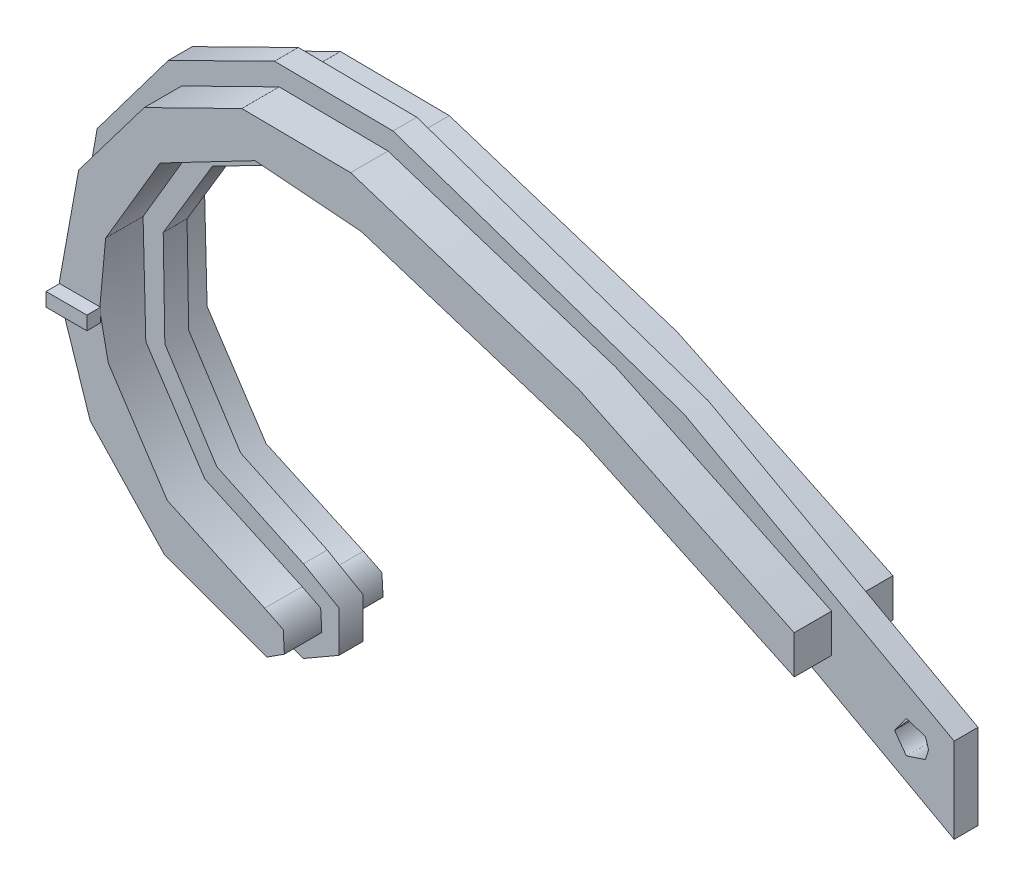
SolidWorks part; units mm, degrees
ref_plane "Plan de face" through (0, 0, 0) normal (0, 0, 1) x (1, 0, 0)
ref_plane "Plan de dessus" through (0, 0, 0) normal (0, 1, 0) x (1, 0, 0)
ref_plane "Plan de droite" through (0, 0, 0) normal (1, 0, 0) x (0, 0, -1)
sketch "Esquisse1" plane through (0, 0, 0) normal (0, 0, 1) x (1, 0, 0)
  line L0 (0, 0) -> (-129, 0) construction
  line L1 (0, 0) -> (0, -12.5)
  line L2 (-82.4299, 36.3971) -> (-82.4299, 23.8971) construction
  line L3 (-91.3509, 0) -> (-129, 0) construction
  arc A0 (0, 0) -> (-82.4299, 36.3971) centre (-146.1025, -219.3442) ccw
  arc A1 (0, -12.5) -> (-82.4299, 23.8971) centre (-146.1025, -231.8442) ccw
  arc A2 (-82.4299, 23.8971) -> (-95.5825, -25.2281) centre (-91.4918, 0) ccw
  arc A3 (-82.4299, 36.3971) -> (-95.5825, -37.2845) centre (-91.4918, 0) ccw
  arc A4 (-95.5825, -25.2281) -> (-95.5825, -37.2845) centre (-95.5825, -31.2563) cw
  dimension "D3" = 12.5
  dimension "D1" = 12.5
  dimension "D2" = 129
extrude "Boss.-Extru.1" add sketch "Esquisse1" along normal blind 14.5
sketch "Esquisse2" plane through (0, 0, 14.5) normal (0, 0, 1) x (1, 0, 0)
  line L2 (0, -12.5) -> (0, 0)
  line L3 (0, -12.5) -> (0, 0)
  line L5 (-3, -6.9669) -> (-3, -1.6123)
  line L6 (-3, -6.9669) -> (-3, -1.6123)
  arc A5 (0, 0) -> (-82.4299, 36.3971) centre (-146.1025, -219.3442) ccw
  arc A6 (0, 0) -> (-82.4299, 36.3971) centre (-146.1025, -219.3442) ccw
  arc A7 (-82.4299, 36.3971) -> (-95.5825, -37.2845) centre (-91.4918, 0) ccw
  arc A8 (-82.4299, 36.3971) -> (-95.5825, -37.2845) centre (-91.4918, 0) ccw
  arc A9 (-95.5825, -37.2845) -> (-95.5825, -25.2281) centre (-95.5825, -31.2563) ccw
  arc A10 (-95.5825, -37.2845) -> (-95.5825, -25.2281) centre (-95.5825, -31.2563) ccw
  arc A11 (-82.4299, 23.8971) -> (-95.5825, -25.2281) centre (-91.4918, 0) ccw
  arc A12 (-82.4299, 23.8971) -> (-95.5825, -25.2281) centre (-91.4918, 0) ccw
  arc A13 (0, -12.5) -> (-82.4299, 23.8971) centre (-146.1025, -231.8442) ccw
  arc A14 (0, -12.5) -> (-82.4299, 23.8971) centre (-146.1025, -231.8442) ccw
  arc A15 (-3, -1.6123) -> (-83.1547, 33.486) centre (-146.1025, -219.3442) ccw
  arc A16 (-3, -1.6123) -> (-83.1547, 33.486) centre (-146.1025, -219.3442) ccw
  arc A17 (-83.1547, 33.486) -> (-95.443, -34.2813) centre (-91.4918, 0) ccw
  arc A18 (-83.1547, 33.486) -> (-95.443, -34.2813) centre (-91.4918, 0) ccw
  arc A19 (-95.443, -34.2813) -> (-95.7766, -28.2343) centre (-95.5825, -31.2563) ccw
  arc A20 (-95.443, -34.2813) -> (-95.7766, -28.2343) centre (-95.5825, -31.2563) ccw
  arc A21 (-81.5368, 26.7663) -> (-95.7766, -28.2343) centre (-91.4918, 0) ccw
  arc A22 (-81.5368, 26.7663) -> (-95.7766, -28.2343) centre (-91.4918, 0) ccw
  arc A23 (-3, -6.9669) -> (-81.5368, 26.7663) centre (-146.1025, -231.8442) ccw
  arc A24 (-3, -6.9669) -> (-81.5368, 26.7663) centre (-146.1025, -231.8442) ccw
  dimension "D1" = 0
  dimension "D2" = 3
extrude "Enlèv. mat.-Extru.1" cut sketch "Esquisse2" against normal blind 5.5
sketch "Esquisse3" plane through (0, 0, 0) normal (0, 0, -1) x (-1, 0, 0)
  line L1 (3, -1.6123) -> (3, -6.9669)
  line L2 (3, -1.6123) -> (3, -6.9669)
  line L3 (0, 0) -> (0, -12.5)
  line L4 (0, 0) -> (0, -12.5)
  arc A5 (83.1547, 33.486) -> (3, -1.6123) centre (146.1025, -219.3442) ccw
  arc A6 (83.1547, 33.486) -> (3, -1.6123) centre (146.1025, -219.3442) ccw
  arc A7 (95.443, -34.2813) -> (83.1547, 33.486) centre (91.4918, 0) ccw
  arc A8 (95.443, -34.2813) -> (83.1547, 33.486) centre (91.4918, 0) ccw
  arc A9 (95.7766, -28.2343) -> (95.443, -34.2813) centre (95.5825, -31.2563) ccw
  arc A10 (95.7766, -28.2343) -> (95.443, -34.2813) centre (95.5825, -31.2563) ccw
  arc A11 (95.7766, -28.2343) -> (81.5368, 26.7663) centre (91.4918, 0) ccw
  arc A12 (95.7766, -28.2343) -> (81.5368, 26.7663) centre (91.4918, 0) ccw
  arc A13 (81.5368, 26.7663) -> (3, -6.9669) centre (146.1025, -231.8442) ccw
  arc A14 (81.5368, 26.7663) -> (3, -6.9669) centre (146.1025, -231.8442) ccw
  arc A15 (82.4299, 36.3971) -> (0, 0) centre (146.1025, -219.3442) ccw
  arc A16 (82.4299, 36.3971) -> (0, 0) centre (146.1025, -219.3442) ccw
  arc A17 (95.5825, -37.2845) -> (82.4299, 36.3971) centre (91.4918, 0) ccw
  arc A18 (95.5825, -37.2845) -> (82.4299, 36.3971) centre (91.4918, 0) ccw
  arc A19 (95.5825, -25.2281) -> (95.5825, -37.2845) centre (95.5825, -31.2563) ccw
  arc A20 (95.5825, -25.2281) -> (95.5825, -37.2845) centre (95.5825, -31.2563) ccw
  arc A21 (95.5825, -25.2281) -> (82.4299, 23.8971) centre (91.4918, 0) ccw
  arc A22 (95.5825, -25.2281) -> (82.4299, 23.8971) centre (91.4918, 0) ccw
  arc A23 (82.4299, 23.8971) -> (0, -12.5) centre (146.1025, -231.8442) ccw
  arc A24 (82.4299, 23.8971) -> (0, -12.5) centre (146.1025, -231.8442) ccw
  dimension "D1" = 0
  dimension "D2" = 0
extrude "Enlèv. mat.-Extru.2" cut sketch "Esquisse3" against normal blind 5.5
sketch "Esquisse4" plane through (0, 0, 14.5) normal (0, 0, 1) x (1, 0, 0)
  line L0 (0, -12.5) -> (0, 0) construction
  line L1 (0, 12.0291) -> (-18, 12.0291)
  line L2 (0, 12.0291) -> (0, -27.9709)
  line L3 (0, -27.9709) -> (-18, -27.9709)
  line L4 (-18, 12.0291) -> (-18, -27.9709)
  dimension "D1" = 18
  dimension "D2" = 40
extrude "Enlèv. mat.-Extru.3" cut sketch "Esquisse4" against normal blind 5.5
sketch "Esquisse5" plane through (0, 0, 0) normal (0, 0, -1) x (-1, 0, 0)
  line L0 (0, 0) -> (0, -12.5) construction
  line L1 (0, 22.5083) -> (18, 22.5083)
  line L2 (0, 22.5083) -> (0, -21.4917)
  line L3 (0, -21.4917) -> (18, -21.4917)
  line L4 (18, 22.5083) -> (18, -21.4917)
  dimension "D1" = 18
  dimension "D2" = 44
extrude "Enlèv. mat.-Extru.4" cut sketch "Esquisse5" against normal blind 5.5
sketch "Esquisse6" plane through (0, 0, 5.5) normal (0, 0, -1) x (-1, 0, 0)
  line L0 (0, 0) -> (12.5, 0) construction
  line L1 (12.5, 0) -> (12.5, -12.5) construction
  line L2 (12.5, -12.5) -> (0, -12.5) construction
  line L3 (0, -12.5) -> (0, 0) construction
  circle A0 centre (6.25, -3) radius 2.5
  dimension "D1" = 5
  dimension "D2" = 12.5
  dimension "D3" = 3
  dimension "D4" = 6.25
extrude "Enlèv. mat.-Extru.5" cut sketch "Esquisse6" against normal through all
sketch "Esquisse7" plane through (0, 0, 14.5) normal (0, 0, 1) x (1, 0, 0)
  line L0 (-6.25, -3) -> (-150.9628, -3) construction
  line L1 (-119.8913, -3) -> (-125.8965, -3)
  arc A0 (-81.5368, 26.7663) -> (-95.7766, -28.2343) centre (-91.4918, 0) ccw construction
extrude "Extru.-Mince1" add sketch "Esquisse7" along normal blind 2 thin
